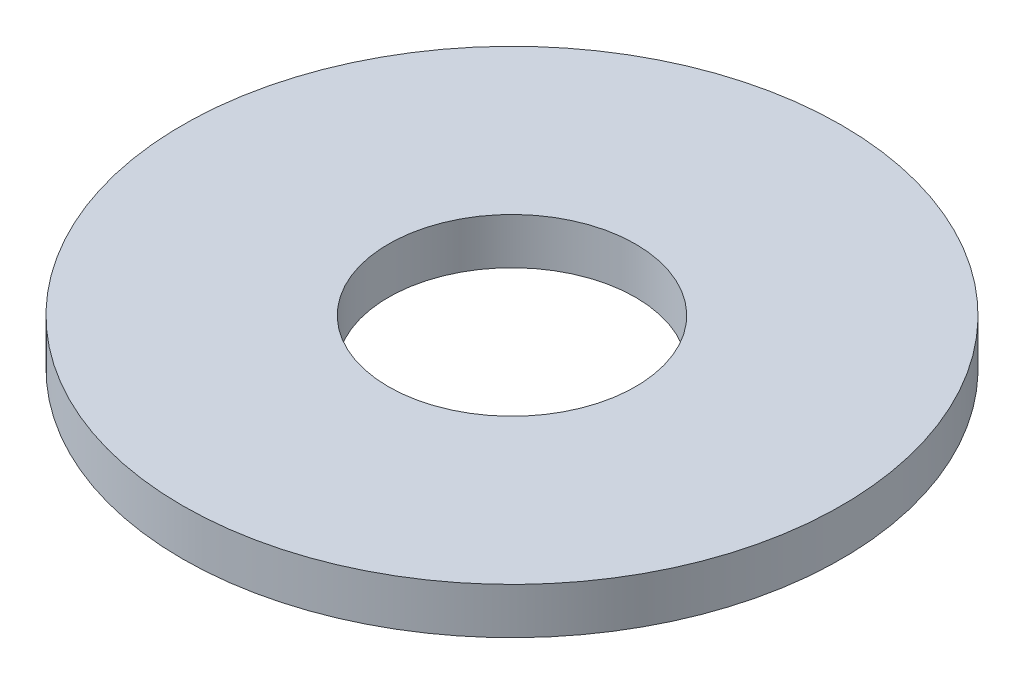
SolidWorks part; units mm, degrees
ref_plane "Front Plane" through (0, 0, 0) normal (0, 0, 1) x (1, 0, 0)
ref_plane "Top Plane" through (0, 0, 0) normal (0, 1, 0) x (1, 0, 0)
ref_plane "Right Plane" through (0, 0, 0) normal (1, 0, 0) x (0, 0, -1)
sketch "Sketch1" plane through (0, 0, 0) normal (0, 1, 0) x (1, 0, 0)
  circle A0 centre (0, 0) radius 12.7
  circle A1 centre (0, 0) radius 4.7625
  dimension "D1" = 25.4
  dimension "D2" = 9.525
extrude "Extrude1" add sketch "Sketch1" along normal blind 1.778
